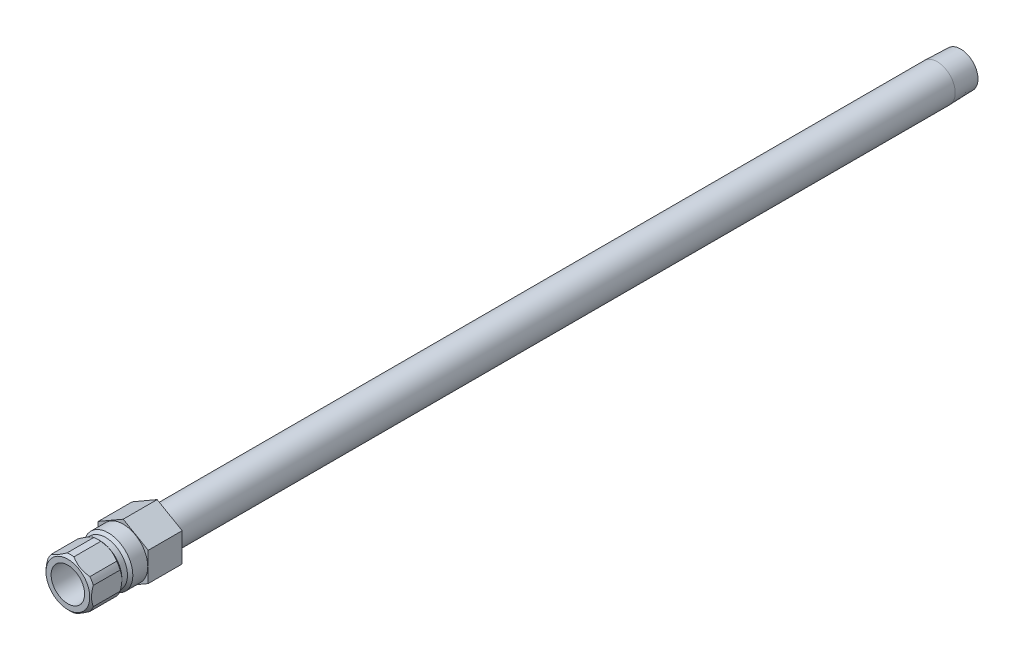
SolidWorks part; units mm, degrees
ref_plane "Front Plane" through (0, 0, 0) normal (0, 0, 1) x (1, 0, 0)
ref_plane "Top Plane" through (0, 0, 0) normal (0, 1, 0) x (1, 0, 0)
ref_plane "Right Plane" through (0, 0, 0) normal (1, 0, 0) x (0, 0, -1)
sketch "Sketch1" plane through (0, 0, 0) normal (1, 0, 0) x (0, 0, -1)
  line L0 (9.652, 0) -> (-18.923, 0) construction
  line L1 (-15.748, 4.7625) -> (-15.748, 6.223)
  line L2 (-6.604, 6.223) -> (-6.604, 0) construction
  line L3 (-14.986, 6.985) -> (-7.366, 6.985)
  line L4 (9.652, 5.1435) -> (9.652, 0) construction
  line L5 (-6.604, 6.223) -> (-5.0165, 6.223)
  line L6 (-4.2545, 6.985) -> (9.652, 6.985)
  line L7 (9.652, 6.985) -> (9.652, 5.1435)
  line L8 (-6.604, 6.223) -> (-7.366, 6.985)
  line L9 (-5.0165, 6.223) -> (-4.2545, 6.985)
  line L10 (-15.748, 6.223) -> (-14.986, 6.985)
  line L11 (-15.748, 4.7625) -> (-3.556, 4.7625)
  line L12 (9.652, 5.1435) -> (231.5718, 5.1435)
  line L13 (231.5718, 5.1435) -> (238.252, 4.9347)
  line L14 (238.252, 4.9347) -> (238.252, 3.4163)
  line L15 (-3.556, 4.7625) -> (-3.556, 6.985) construction
  line L16 (9.652, 6.731) -> (9.652, 0) construction
  line L17 (-3.556, 4.7625) -> (-2.8402, 3.4163)
  line L19 (-2.8402, 3.4163) -> (238.252, 3.4163)
  dimension "D2" = 1.5875
  dimension "D3" = 0.762
  dimension "D4" = 45
  dimension "D5" = 9.144
  dimension "D6" = 45
  dimension "D7" = 1.79
  dimension "D8" = 6.6802
  dimension "D9" = 254
  dimension "D10" = 3.175
  dimension "D11" = 9.525
  dimension "D12" = 10.287
  dimension "D13" = 25.4
  dimension "D14" = 13.97
  dimension "D15" = 6.8326
  dimension "D16" = 15.748
  dimension "D17" = 12.192
  dimension "D18" = 118
revolve "Revolve1" add sketch "Sketch1" angle 360 about L0
sketch "Sketch2" plane through (0, 0, 0) normal (0, 0, 1) x (1, 0, 0)
  line L1 (-7.112, 4.1061) -> (-7.112, -4.1061)
  line L2 (-7.112, -4.1061) -> (0, -8.2122)
  line L3 (0, -8.2122) -> (7.112, -4.1061)
  line L4 (7.112, -4.1061) -> (7.112, 4.1061)
  line L5 (7.112, 4.1061) -> (0, 8.2122)
  line L6 (0, 8.2122) -> (-7.112, 4.1061)
  circle A0 centre (0, 0) radius 7.112 construction
  circle A1 centre (0, 0) radius 4.7625 construction
  circle A2 centre (0, 0) radius 4.7625
  dimension "D1" = 14.224
extrude "Boss-Extrude1" add sketch "Sketch2" against normal up to vertex (9.652 mm away)
sketch "Sketch3" plane through (0, 0, 0) normal (0, 0, 1) x (1, 0, 0)
  line L1 (6.477, 3.7395) -> (0, 7.479)
  line L2 (0, 7.479) -> (-6.477, 3.7395)
  line L3 (-6.477, 3.7395) -> (-6.477, -3.7395)
  line L4 (-6.477, -3.7395) -> (0, -7.479)
  line L5 (0, -7.479) -> (6.477, -3.7395)
  line L6 (6.477, -3.7395) -> (6.477, 3.7395)
  circle A0 centre (0, 0) radius 6.477 construction
  dimension "D1" = 12.954
extrude "Cut-Extrude1" cut sketch "Sketch3" along normal through all from vertex at 6.604 flip side to cut
